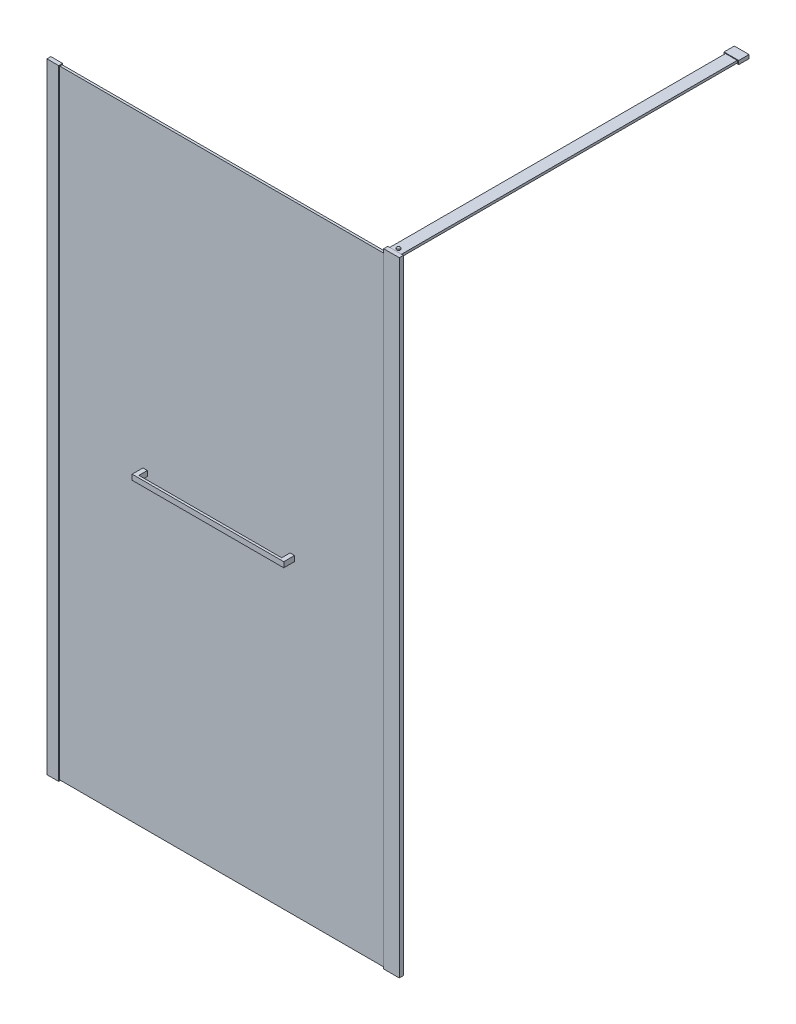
SolidWorks part; units mm, degrees
ref_plane "Płaszczyzna przednia" through (0, 0, 0) normal (0, 0, 1) x (1, 0, 0)
ref_plane "Płaszczyzna górna" through (0, 0, 0) normal (0, 1, 0) x (1, 0, 0)
ref_plane "Płaszczyzna prawa" through (0, 0, 0) normal (1, 0, 0) x (0, 0, -1)
sketch "Szkic1" plane through (0, 0, 0) normal (0, 1, 0) x (1, 0, 0)
  line L0 (0, 0) -> (0, 13.3)
  line L1 (0, 13.3) -> (40, 13.3)
  line L2 (40, 13.3) -> (40, 11.4)
  line L3 (40, 11.4) -> (6.5, 11.4)
  line L4 (6.5, 11.4) -> (6.5, 3.4)
  line L5 (6.5, 3.4) -> (40, 3.4)
  line L6 (40, 3.4) -> (40, 0)
  line L7 (40, 0) -> (0, 0)
  dimension "D1" = 40
  dimension "D2" = 13.3
  dimension "D3" = 33.5
  dimension "D4" = 1.9
  dimension "D5" = 8
extrude "Dodanie-wyciągnięcie1" add sketch "Szkic1" along normal blind 2100 from offset 3
sketch "Szkic2" plane through (0, 3, 0) normal (0, -1, 0) x (1, 0, 0)
  line L0 (6.5, -11.4) -> (40, -11.4) construction
  line L1 (6.5, -3.4) -> (1153.5, -3.4)
  line L2 (6.5, -3.4) -> (6.5, -11.4)
  line L3 (6.5, -11.4) -> (1153.5, -11.4)
  line L4 (1153.5, -3.4) -> (1153.5, -11.4)
  dimension "D1" = 1147
extrude "Dodanie-wyciągnięcie2" add sketch "Szkic2" against normal blind 2100 separate body
sketch "Szkic3" plane through (0, 3, 0) normal (0, -1, 0) x (1, 0, 0)
  line L0 (1143.4, -3.4) -> (1143.4, -0.4)
  line L1 (1153.5, -3.4) -> (6.5, -3.4) construction
  line L2 (1143.4, -0.4) -> (1196.4, -0.4)
  line L3 (1196.4, -0.4) -> (1196.4, -14.4)
  line L4 (1196.4, -14.4) -> (1143.4, -14.4)
  line L5 (1143.4, -14.4) -> (1143.4, -11.4)
  line L6 (1143.4, -11.4) -> (1153.5, -11.4)
  line L7 (1153.5, -11.4) -> (1153.5, -3.4)
  line L8 (1153.5, -3.4) -> (1143.4, -3.4)
  line L9 (6.5, -11.4) -> (1153.5, -11.4) construction
  line L10 (1153.5, -11.4) -> (1153.5, -3.4) construction
  dimension "D1" = 10.1
  dimension "D2" = 3
  dimension "D3" = 3
  dimension "D4" = 53
extrude "Dodanie-wyciągnięcie3" add sketch "Szkic3" against normal blind 2108 separate body
sketch "Szkic4" plane through (0, 2103, 0) normal (0, 1, 0) x (1, 0, 0)
  line L1 (0, 13.3) -> (40, 13.3)
  line L2 (0, 13.3) -> (0, 0)
  line L3 (0, 0) -> (40, 0)
  line L4 (40, 13.3) -> (40, 0)
extrude "Dodanie-wyciągnięcie4" add sketch "Szkic4" along normal blind 3
sketch "Szkic5" plane through (0, 2111, 0) normal (0, 1, 0) x (1, 0, 0)
  line L1 (1196.4, 14.4) -> (1143.4, 14.4)
  line L2 (1196.4, 14.4) -> (1196.4, 0.4)
  line L3 (1196.4, 0.4) -> (1143.4, 0.4)
  line L4 (1143.4, 14.4) -> (1143.4, 0.4)
extrude "Dodanie-wyciągnięcie5" add sketch "Szkic5" along normal blind 8
sketch "Szkic6" plane through (1143.4, 0, 0) normal (-1, 0, 0) x (0, 0, 1)
  line L0 (-11.4, 2111) -> (-3.4, 2111) construction
  line L1 (-3.35, 2111) -> (-11.45, 2111)
  line L2 (-3.35, 2111) -> (-3.35, 2103.2)
  line L3 (-3.35, 2103.2) -> (-11.45, 2103.2)
  line L4 (-11.45, 2111) -> (-11.45, 2103.2)
  point P6 (-7.4, 2111)
  dimension "D1" = 8.1
  dimension "D2" = 7.8
extrude "Dodanie-wyciągnięcie6" add sketch "Szkic6" against normal blind 15 from offset 1.3
sketch "Szkic7" plane through (0, 3, 0) normal (0, -1, 0) x (1, 0, 0)
  line L1 (1143.4, -0.4) -> (1196.4, -0.4)
  line L2 (1143.4, -0.4) -> (1143.4, -14.4)
  line L3 (1143.4, -14.4) -> (1196.4, -14.4)
  line L4 (1196.4, -0.4) -> (1196.4, -14.4)
extrude "Dodanie-wyciągnięcie7" add sketch "Szkic7" along normal blind 3
sketch "Szkic8" plane through (0, 3, 0) normal (0, -1, 0) x (1, 0, 0)
  line L1 (0, 0) -> (40, 0)
  line L2 (0, 0) -> (0, -13.3)
  line L3 (0, -13.3) -> (40, -13.3)
  line L4 (40, 0) -> (40, -13.3)
extrude "Dodanie-wyciągnięcie8" add sketch "Szkic8" along normal blind 3
sketch "Szkic9" plane through (0, 0, -14.4) normal (0, 0, -1) x (-1, 0, 0)
  line L0 (-1196.4, 2119) -> (-1143.4, 2119) construction
  line L1 (-1189.9, 2119) -> (-1149.9, 2119)
  line L2 (-1189.9, 2119) -> (-1189.9, 2111)
  line L3 (-1189.9, 2111) -> (-1149.9, 2111)
  line L4 (-1149.9, 2119) -> (-1149.9, 2111)
  line L5 (-1196.4, 2119) -> (-1196.4, 0) construction
  line L6 (-1143.4, 2119) -> (-1143.4, 0) construction
  dimension "D1" = 6.5
  dimension "D2" = 6.5
  dimension "D3" = 8
extrude "Dodanie-wyciągnięcie9" add sketch "Szkic9" along normal blind 1170 separate body
sketch "Szkic10" plane through (0, 0, -1184.4) normal (0, 0, -1) x (-1, 0, 0)
  line L0 (-1169.9, 2119) -> (-1169.9, 2115) construction
  line L1 (-1194.9, 2121.25) -> (-1144.9, 2121.25)
  line L2 (-1194.9, 2121.25) -> (-1194.9, 2108.75)
  line L3 (-1194.9, 2108.75) -> (-1144.9, 2108.75)
  line L4 (-1144.9, 2121.25) -> (-1144.9, 2108.75)
  line L5 (-1194.9, 2121.25) -> (-1144.9, 2108.75) construction
  line L6 (-1194.9, 2108.75) -> (-1144.9, 2121.25) construction
  line L7 (-1149.9, 2119) -> (-1189.9, 2119) construction
  line L8 (-1169.9, 2115) -> (-1189.9, 2115) construction
  line L9 (-1189.9, 2119) -> (-1189.9, 2111) construction
  point P0 (-1169.9, 2115)
  dimension "D1" = 12.5
  dimension "D2" = 50
extrude "Dodanie-wyciągnięcie10" add sketch "Szkic10" along normal blind 35 from offset 29.4
ref_plane "Płaszczyzna1" through (1169.9, 0, 0) normal (1, 0, 0) x (0, 0, -1)
sketch "Szkic11" plane through (1169.9, 0, 0) normal (1, 0, 0) x (0, 0, -1)
  line L0 (24.4, 2119) -> (24.4, 2127.4416) construction
  line L1 (24.4, 2119) -> (34.6926, 2119) construction
  line L2 (30.3, 2119) -> (30.05, 2122.8)
  line L3 (24.4, 2124.7) -> (30.2413, 2124.7) construction
  line L4 (24.4, 2124.7) -> (24.4, 2124.2)
  line L5 (1155, 2119) -> (14.4, 2119) construction
  line L6 (14.4, 2119) -> (14.4, 2111) construction
  line L7 (29.7989, 2119) -> (30.3, 2119)
  line L9 (29.5663, 2122.5357) -> (29.7989, 2119)
  arc A0 (24.4, 2124.7) -> (30.05, 2122.8) centre (24.4, 2115.3493) cw
  arc A1 (29.5663, 2122.5357) -> (24.4, 2124.2) centre (24.4, 2115.3493) ccw
  dimension "D1" = 0.5
  dimension "D2" = 11.3
  dimension "D3" = 5.7
  dimension "D4" = 3.8
  dimension "D5" = 11.8
  dimension "D6" = 0.5
  dimension "D7" = 10
revolve "Obrót1" add sketch "Szkic11" angle 360 about L0
sketch "Szkic12" plane through (0, 0, -3.4) normal (0, 0, 1) x (1, 0, 0)
  line L0 (580, 1409.7928) -> (580, 762.3594) construction
  line L1 (330, 1053) -> (830, 1053) construction
  line L2 (6.5, 2103) -> (6.5, 3) construction
  line L3 (1153.5, 2103) -> (1153.5, 3) construction
  line L5 (322.5, 1062) -> (337.5, 1062)
  line L6 (322.5, 1062) -> (322.5, 1044)
  line L7 (322.5, 1044) -> (337.5, 1044)
  line L8 (337.5, 1062) -> (337.5, 1044)
  line L9 (322.5, 1062) -> (337.5, 1044) construction
  line L10 (322.5, 1044) -> (337.5, 1062) construction
  line L11 (822.5, 1062) -> (837.5, 1062)
  line L12 (822.5, 1062) -> (822.5, 1044)
  line L13 (822.5, 1044) -> (837.5, 1044)
  line L14 (837.5, 1062) -> (837.5, 1044)
  line L15 (822.5, 1062) -> (837.5, 1044) construction
  line L16 (822.5, 1044) -> (837.5, 1062) construction
  dimension "D1" = 1053
  dimension "D2" = 500
  dimension "D3" = 15
  dimension "D4" = 18
extrude "Dodanie-wyciągnięcie11" add sketch "Szkic12" along normal blind 36.5 and the other way blind 18 separate body
sketch "Szkic13" plane through (337.5, 0, 0) normal (1, 0, 0) x (0, 0, -1)
  line L0 (21.4, 1044) -> (-33.1, 1044) construction
  line L1 (-33.1, 1062) -> (-25.1, 1062)
  line L2 (-33.1, 1062) -> (-33.1, 1044)
  line L3 (-33.1, 1044) -> (-25.1, 1044)
  line L4 (-25.1, 1062) -> (-25.1, 1044)
  dimension "D1" = 8
extrude "Dodanie-wyciągnięcie12" add sketch "Szkic13" along normal up to surface (485 mm away)
